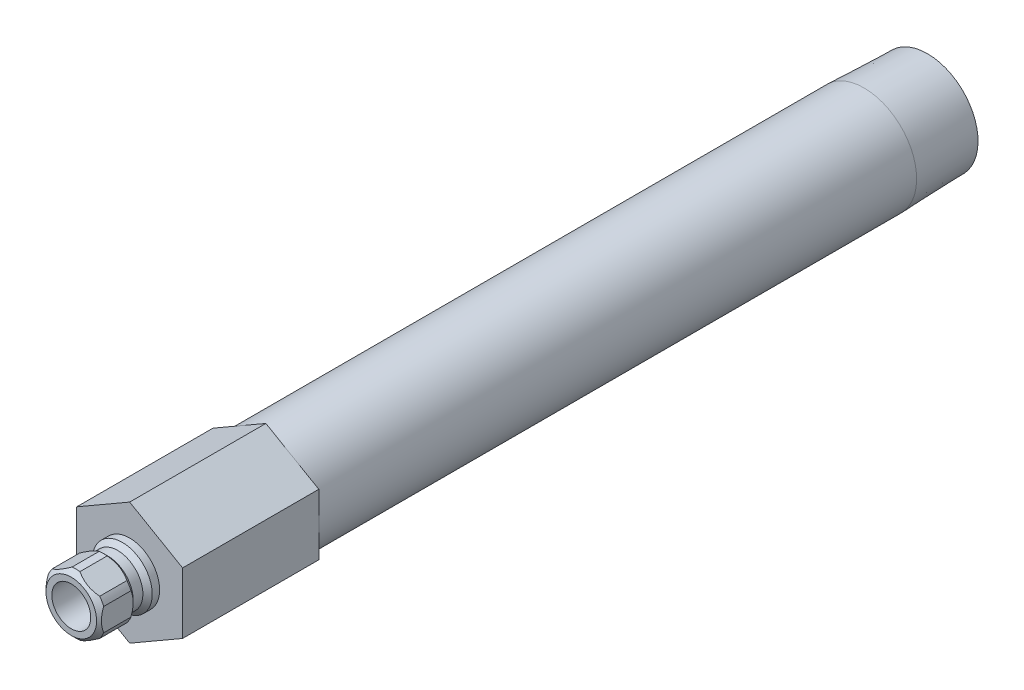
SolidWorks part; units mm, degrees
ref_plane "Front Plane" through (0, 0, 0) normal (0, 0, 1) x (1, 0, 0)
ref_plane "Top Plane" through (0, 0, 0) normal (0, 1, 0) x (1, 0, 0)
ref_plane "Right Plane" through (0, 0, 0) normal (1, 0, 0) x (0, 0, -1)
sketch "Sketch1" plane through (0, 0, 0) normal (1, 0, 0) x (0, 0, -1)
  line L0 (0, 0) -> (-12.7, 0) construction
  line L1 (-9.525, 3.175) -> (-9.525, 4.1275)
  line L2 (-3.556, 4.1275) -> (-3.556, 0) construction
  line L3 (-8.763, 4.8895) -> (-4.318, 4.8895)
  line L4 (0, 8.5725) -> (0, 0) construction
  line L5 (-3.556, 4.1275) -> (-1.9685, 4.1275)
  line L6 (-1.2065, 4.8895) -> (0, 4.8895)
  line L7 (0, 4.8895) -> (0, 8.5725)
  line L8 (-3.556, 4.1275) -> (-4.318, 4.8895)
  line L9 (-1.9685, 4.1275) -> (-1.2065, 4.8895)
  line L10 (-9.525, 4.1275) -> (-8.763, 4.8895)
  line L11 (-9.525, 3.175) -> (22.225, 3.175)
  line L12 (0, 8.5725) -> (119.8372, 8.5725)
  line L13 (119.8372, 8.5725) -> (130.175, 8.2494)
  line L14 (130.175, 8.2494) -> (130.175, 6.2611)
  line L15 (0, 0) -> (22.225, 0) construction
  line L16 (22.225, 0) -> (22.225, 3.175) construction
  line L17 (22.225, 4.8895) -> (0, 4.8895) construction
  line L18 (22.225, 3.175) -> (22.225, 6.2611)
  line L19 (22.225, 6.2611) -> (130.175, 6.2611)
  line L20 (22.225, 3.175) -> (22.225, 4.8895) construction
  dimension "D1" = 9.525
  dimension "D2" = 1.5875
  dimension "D3" = 0.762
  dimension "D4" = 45
  dimension "D5" = 5.969
  dimension "D6" = 45
  dimension "D7" = 1.79
  dimension "D8" = 10.3378
  dimension "D9" = 139.7
  dimension "D10" = 3.175
  dimension "D11" = 31.75
  dimension "D12" = 6.35
  dimension "D13" = 12.5222
  dimension "D14" = 9.779
  dimension "D15" = 17.145
revolve "Revolve1" add sketch "Sketch1" angle 360 about L0
sketch "Sketch2" plane through (0, 0, 0) normal (0, 0, 1) x (1, 0, 0)
  line L1 (-8.636, 4.986) -> (-8.636, -4.986)
  line L2 (-8.636, -4.986) -> (0, -9.972)
  line L3 (0, -9.972) -> (8.636, -4.986)
  line L4 (8.636, -4.986) -> (8.636, 4.986)
  line L5 (8.636, 4.986) -> (0, 9.972)
  line L6 (0, 9.972) -> (-8.636, 4.986)
  circle A0 centre (0, 0) radius 8.636 construction
  circle A1 centre (0, 0) radius 3.175 construction
  circle A2 centre (0, 0) radius 3.175
  dimension "D1" = 17.272
extrude "Boss-Extrude1" add sketch "Sketch2" against normal up to vertex (22.225 mm away) from vertex at 0
sketch "Sketch3" plane through (0, 0, 0) normal (0, 0, 1) x (1, 0, 0)
  line L1 (4.5212, 2.6103) -> (0, 5.2206)
  line L2 (0, 5.2206) -> (-4.5212, 2.6103)
  line L3 (-4.5212, 2.6103) -> (-4.5212, -2.6103)
  line L4 (-4.5212, -2.6103) -> (0, -5.2206)
  line L5 (0, -5.2206) -> (4.5212, -2.6103)
  line L6 (4.5212, -2.6103) -> (4.5212, 2.6103)
  circle A0 centre (0, 0) radius 4.5212 construction
  dimension "D1" = 9.0424
extrude "Cut-Extrude1" cut sketch "Sketch3" along normal through all from vertex at 3.556 flip side to cut
